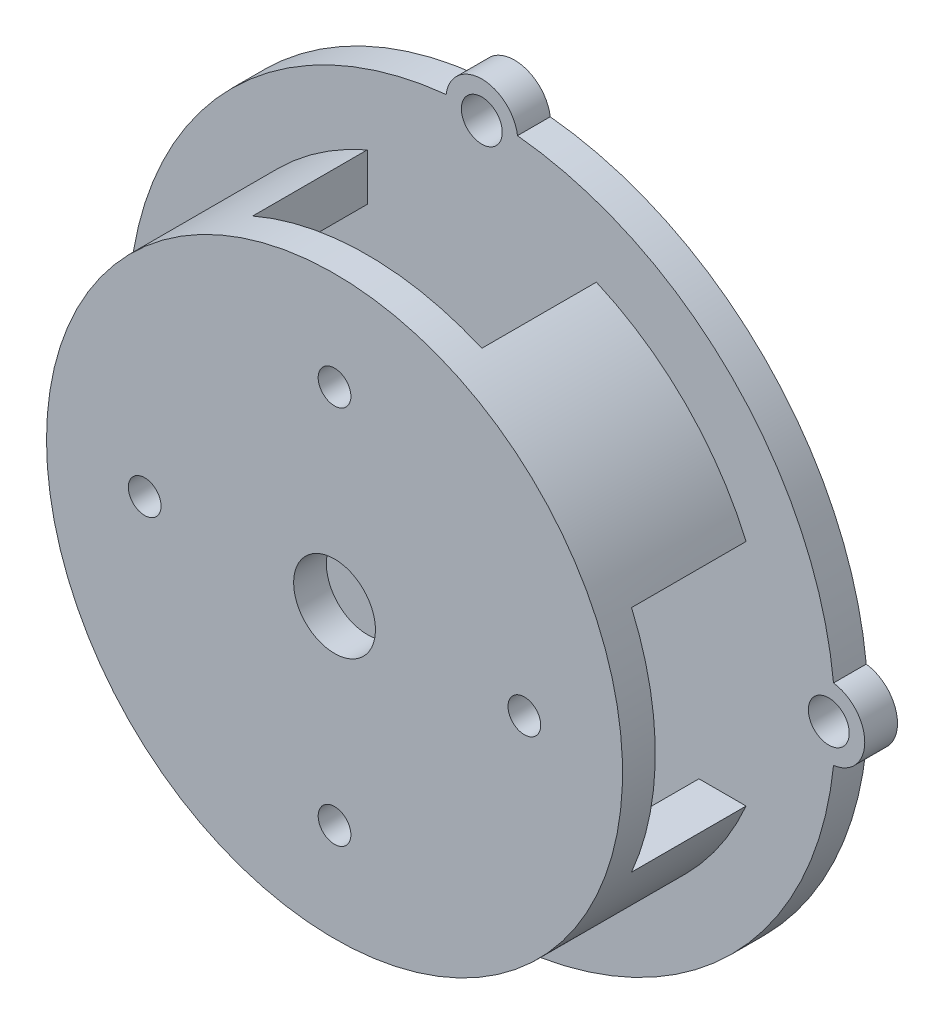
SolidWorks part; units mm, degrees
ref_plane "Alzado" through (0, 0, 0) normal (0, 0, 1) x (1, 0, 0)
ref_plane "Planta" through (0, 0, 0) normal (0, 1, 0) x (1, 0, 0)
ref_plane "Vista lateral" through (0, 0, 0) normal (1, 0, 0) x (0, 0, -1)
sketch "Croquis1" plane through (0, 0, 0) normal (0, 0, 1) x (1, 0, 0)
  circle A0 centre (0, 0) radius 108
  dimension "D1" = 216
extrude "Saliente-Extruir1" add sketch "Croquis1" along normal blind 55
sketch "Croquis2" plane through (0, 0, 0) normal (0, 1, 0) x (1, 0, 0)
  line L0 (0, 0) -> (0, -43.1738) construction
  line L1 (-108, 0) -> (-108, -55) construction
  line L2 (-108, -10) -> (-88, -10)
  line L3 (-88, -10) -> (-88, -55)
  line L4 (-108, -55) -> (108, -55) construction
  line L5 (-88, -55) -> (-108, -55)
  line L6 (-108, -55) -> (-108, -10)
  dimension "D1" = 45
  dimension "D2" = 20
revolve "Cortar-Revolución1" cut sketch "Croquis2" angle 360 about L0
sketch "Croquis4" plane through (0, 0, 0) normal (0, 0, -1) x (-1, 0, 0)
  circle A0 centre (0, 106) radius 11
  circle A1 centre (106, 0) radius 11
  circle A2 centre (0, -106) radius 11
  circle A3 centre (-106, 0) radius 11
  dimension "D2" = 22
  dimension "D1" = 106
  dimension "D3" = 4
extrude "Saliente-Extruir2" add sketch "Croquis4" against normal blind 10
sketch "Croquis8" plane through (0, 0, 0) normal (0, 0, -1) x (-1, 0, 0)
  circle A0 centre (0, 106) radius 6.25
  circle A1 centre (106, 0) radius 6.25
  circle A2 centre (0, -106) radius 6.25
  circle A3 centre (-106, 0) radius 6.25
  dimension "D1" = 12.5
  dimension "D3" = 106
  dimension "D2" = 4
extrude "Cortar-Extruir2" cut sketch "Croquis8" against normal up to next
sketch "Croquis9" plane through (0, 0, 0) normal (0, 1, 0) x (1, 0, 0)
  line L0 (-35, -45) -> (-35, -10)
  line L2 (-88, -10) -> (88, -10) construction
  line L3 (-35, -45) -> (35, -45)
  line L4 (35, -45) -> (35, -10)
  line L5 (10.9043, -10) -> (107.4481, -10) construction
  line L6 (-35, -10) -> (35, -10)
  dimension "D2" = 70
extrude "Cortar-Extruir3" cut sketch "Croquis9" against normal up to next from offset 108
sketch "Croquis10" plane through (0, 0, 0) normal (1, 0, 0) x (0, 0, -1)
  line L0 (-45, 35) -> (-10, 35)
  line L2 (-10, 35) -> (-10, -35)
  line L3 (-45, 35) -> (-45, -35)
  line L4 (-45, -35) -> (-10, -35)
  line L5 (-10, 80.7403) -> (-10, -80.7403) construction
  dimension "D1" = 35
  dimension "D3" = 70
extrude "Cortar-Extruir4" cut sketch "Croquis10" against normal blind 108 and the other way blind 108
ref_plane "Plano1" through (0, 0, 45) normal (0, 0, 1) x (1, 0, 0)
sketch "Croquis11" plane through (0, 0, 45) normal (0, 0, 1) x (1, 0, 0)
  circle A0 centre (0, 0) radius 75
  dimension "D1" = 150
extrude "Cortar-Extruir5" cut sketch "Croquis11" against normal blind 35
sketch "Croquis13" plane through (0, 0, 0) normal (0, 0, -1) x (-1, 0, 0)
  circle A0 centre (0, 0) radius 92.5
  circle A1 centre (0, 0) radius 85
  dimension "D1" = 185
  dimension "D2" = 170
extrude "Saliente-Extruir3" add sketch "Croquis13" along normal blind 10
sketch "Croquis14" plane through (0, 0, 0) normal (0, 0, -1) x (-1, 0, 0)
  circle A0 centre (0, 0) radius 12.5
  circle A1 centre (0, 0) radius 17.5
  dimension "D1" = 25
  dimension "D2" = 35
extrude "Saliente-Extruir4" add sketch "Croquis14" along normal blind 5
sketch "Croquis15" plane through (0, 0, 0) normal (0, 0, -1) x (-1, 0, 0)
  circle A0 centre (0, 0) radius 12.5
  dimension "D1" = 25
extrude "Cortar-Extruir6" cut sketch "Croquis15" against normal blind 55
sketch "Croquis16" plane through (0, 0, 55) normal (0, 0, 1) x (1, 0, 0)
  circle A0 centre (0, 58) radius 5
  circle A1 centre (58, 0) radius 5
  circle A2 centre (0, -58) radius 5
  circle A3 centre (-58, 0) radius 5
  dimension "D2" = 10
  dimension "D1" = 58
  dimension "D3" = 4
extrude "Cortar-Extruir7" cut sketch "Croquis16" against normal blind 10
